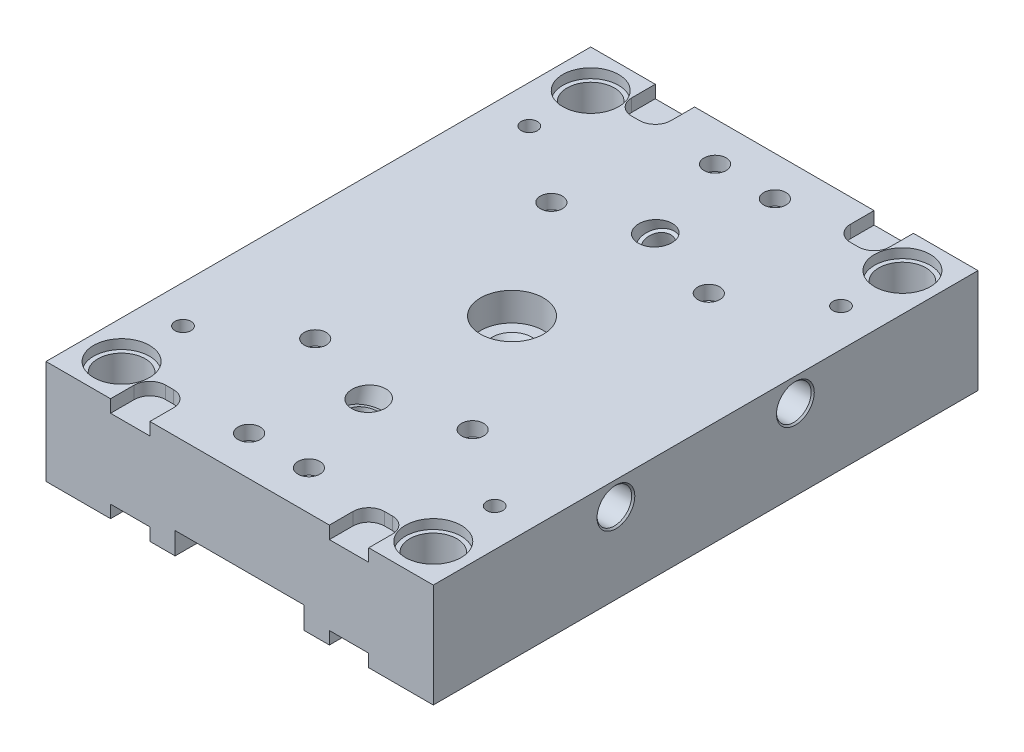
SolidWorks part; units mm, degrees
ref_plane "Plan de face" through (0, 0, 0) normal (0, 0, 1) x (1, 0, 0)
ref_plane "Plan de dessus" through (0, 0, 0) normal (0, 1, 0) x (1, 0, 0)
ref_plane "Plan de droite" through (0, 0, 0) normal (1, 0, 0) x (0, 0, -1)
imported_body "Importée1"
ref_plane "Plan1" through (0, 51, 0) normal (0, 1, 0) x (-1, 0, 0)
sketch "Esquisse1" plane through (0, 51, 17945.6822) normal (0, -1, 0) x (-1, 0, 0)
  line L0 (-85.6565, 17823.6822) -> (-85.6565, 17817.3501)
  line L1 (-101, 17816.8724) -> (-89.3091, 17817.2364) construction
  line L2 (-101, 17816.8724) -> (-85.6565, 17817.3501)
  line L3 (-85.0055, 17823.6822) -> (-126.4077, 17823.6822) construction
  line L4 (-101, 17823.6822) -> (-101, 17816.8724)
  line L5 (-85.0055, 17827.6822) -> (-85.0055, 17819.6822) construction
  line L6 (-85.6565, 17828.8097) -> (-85.6565, 17818.5547) construction
  line L7 (-101, 17834.6822) -> (-101, 17812.6822) construction
  line L8 (-85.6565, 17823.6822) -> (-101, 17823.6822)
revolve "Enlèvement de matière-Révolution1" cut sketch "Esquisse1" angle 360 about L3
pattern_linear "Répétition linéaire1" count 2 spacing 114 along (0, 0, -1) of "Enlèvement de matière-Révolution1"
